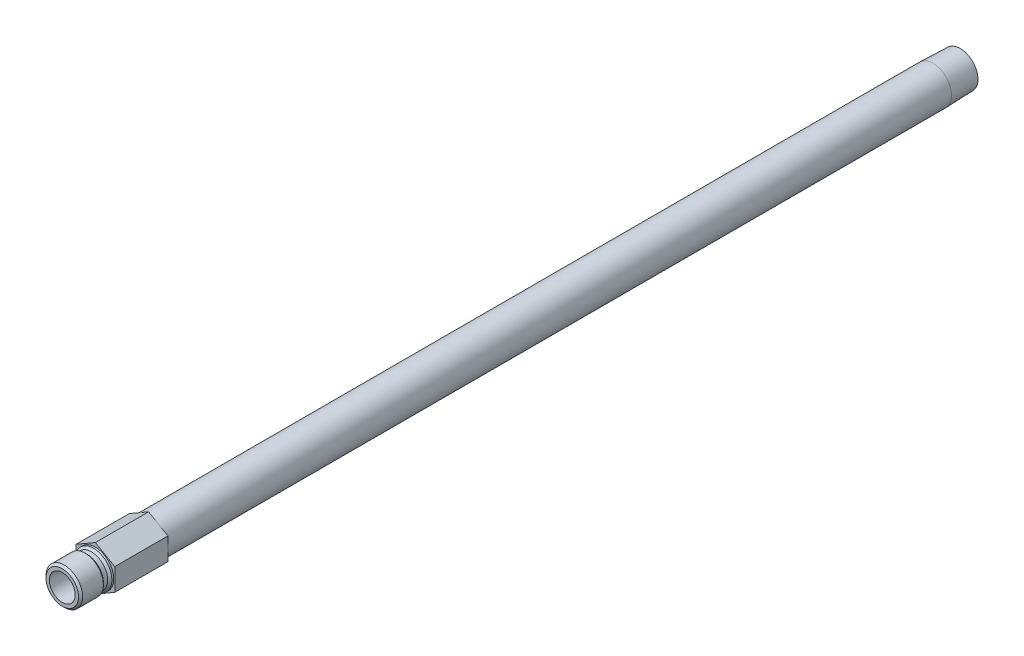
SolidWorks part; units mm, degrees
ref_plane "Front Plane" through (0, 0, 0) normal (0, 0, 1) x (1, 0, 0)
ref_plane "Top Plane" through (0, 0, 0) normal (0, 1, 0) x (1, 0, 0)
ref_plane "Right Plane" through (0, 0, 0) normal (1, 0, 0) x (0, 0, -1)
sketch "Sketch1" plane through (0, 0, 0) normal (1, 0, 0) x (0, 0, -1)
  line L0 (0, 0) -> (-15.367, 0) construction
  line L1 (-12.192, 4.7625) -> (-12.192, 5.9817)
  line L2 (-3.048, 5.9817) -> (-3.048, 0) construction
  line L3 (-11.43, 6.7437) -> (-3.81, 6.7437)
  line L4 (0, 6.858) -> (0, 4.7625) construction
  line L5 (-3.048, 5.9817) -> (-1.4605, 5.9817)
  line L6 (-0.6985, 6.7437) -> (0, 6.7437)
  line L7 (0, 6.7437) -> (0, 6.858)
  line L8 (-3.048, 5.9817) -> (-3.81, 6.7437)
  line L9 (-1.4605, 5.9817) -> (-0.6985, 6.7437)
  line L10 (-12.192, 5.9817) -> (-11.43, 6.7437)
  line L11 (-12.192, 4.7625) -> (0, 4.7625)
  line L12 (0, 6.858) -> (307.975, 6.858)
  line L13 (307.975, 6.858) -> (318.008, 6.5445)
  line L14 (318.008, 6.5445) -> (318.008, 4.6228)
  line L15 (0, 6.7437) -> (19.558, 6.7437) construction
  line L16 (19.558, 6.7437) -> (19.558, 0) construction
  line L17 (19.558, 0) -> (0, 0) construction
  line L19 (0.0743, 4.6228) -> (318.008, 4.6228)
  line L20 (0, 4.7625) -> (0.0743, 4.6228)
  line L21 (0, 4.6272) -> (0, 0) construction
  dimension "D2" = 1.5875
  dimension "D3" = 0.762
  dimension "D4" = 45
  dimension "D5" = 9.144
  dimension "D6" = 45
  dimension "D7" = 1.79
  dimension "D8" = 10.033
  dimension "D9" = 330.2
  dimension "D10" = 3.175
  dimension "D11" = 9.525
  dimension "D12" = 13.716
  dimension "D13" = 31.75
  dimension "D14" = 13.4874
  dimension "D15" = 9.2456
  dimension "D16" = 19.558
  dimension "D17" = 118
  dimension "D18" = 12.192
revolve "Revolve1" add sketch "Sketch1" angle 360 about L0
sketch "Sketch2" plane through (0, 0, 0) normal (0, 0, 1) x (1, 0, 0)
  line L1 (-7.112, 4.1061) -> (-7.112, -4.1061)
  line L2 (-7.112, -4.1061) -> (0, -8.2122)
  line L3 (0, -8.2122) -> (7.112, -4.1061)
  line L4 (7.112, -4.1061) -> (7.112, 4.1061)
  line L5 (7.112, 4.1061) -> (0, 8.2122)
  line L6 (0, 8.2122) -> (-7.112, 4.1061)
  circle A0 centre (0, 0) radius 7.112 construction
  circle A1 centre (0, 0) radius 4.6228 construction
  circle A2 centre (0, 0) radius 4.6228
  dimension "D1" = 14.224
extrude "Boss-Extrude1" add sketch "Sketch2" against normal up to vertex (19.558 mm away) from vertex at 0
